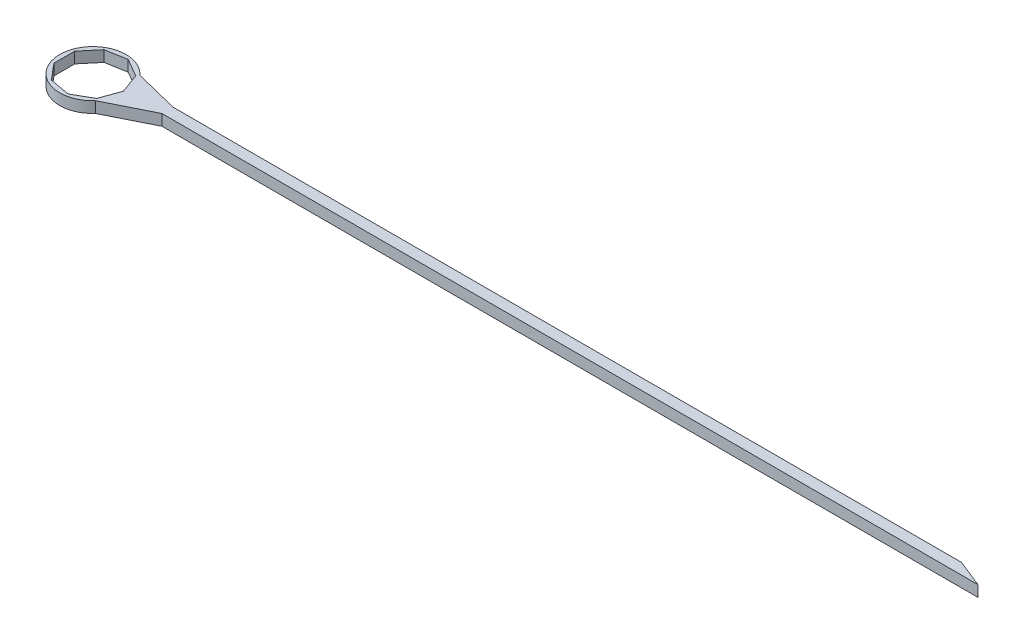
SolidWorks part; units mm, degrees
ref_plane "Front Plane" through (0, 0, 0) normal (0, 0, 1) x (1, 0, 0)
ref_plane "Top Plane" through (0, 0, 0) normal (0, 1, 0) x (1, 0, 0)
ref_plane "Right Plane" through (0, 0, 0) normal (1, 0, 0) x (0, 0, -1)
sketch "Sketch1" plane through (0, 0, 0) normal (0, 1, 0) x (1, 0, 0)
  line L0 (6.2361, 0) -> (80, 0)
  line L1 (2.75, 0) -> (2.1066, 1.7677)
  line L2 (2.1066, 1.7677) -> (0.4775, 2.7082)
  line L3 (0.4775, 2.7082) -> (-1.375, 2.3816)
  line L4 (-1.375, 2.3816) -> (-2.5842, 0.9406)
  line L5 (-2.5842, 0.9406) -> (-2.5842, -0.9406)
  line L6 (-2.5842, -0.9406) -> (-1.375, -2.3816)
  line L7 (-1.375, -2.3816) -> (0.4775, -2.7082)
  line L8 (0.4775, -2.7082) -> (2.1066, -1.7677)
  line L9 (2.1066, -1.7677) -> (2.75, 0)
  line L10 (80, 0) -> (77.5, 1)
  line L11 (77.5, 1) -> (6.2361, 1)
  line L12 (6.2361, 1) -> (2.2361, 2)
  line L13 (6.2361, 0) -> (2.2361, -2)
  arc A0 (2.2361, 2) -> (2.2361, -2) centre (0, 0) ccw
  circle A1 centre (0, 0) radius 2.75 construction
  dimension "D1" = 6
  dimension "D2" = 5.5
  dimension "D3" = 1
  dimension "D4" = 2.5
  dimension "D5" = 2
  dimension "D6" = 4
  dimension "D7" = 80
  dimension "D8" = 2
extrude "Boss-Extrude1" add sketch "Sketch1" along normal blind 1
sketch "Sketch2" plane through (0, 1, 0) normal (0, 1, 0) x (1, 0, 0)
  line L0 (0, 0) -> (16, 0)
  line L1 (6.2361, 0) -> (80, 0) construction
  line L2 (16, 0) -> (23.6429, 0)
  line L3 (23.6429, 0) -> (31.2857, 0)
  line L4 (31.2857, 0) -> (38.9286, 0)
  line L5 (38.9286, 0) -> (46.5714, 0)
  line L6 (46.5714, 0) -> (54.2143, 0)
  line L7 (54.2143, 0) -> (61.8571, 0)
  line L8 (61.8571, 0) -> (69.5, 0)
  line L10 (69.5, 0) -> (77.5, 0)
  dimension "D1" = 16
  dimension "D2" = 8
